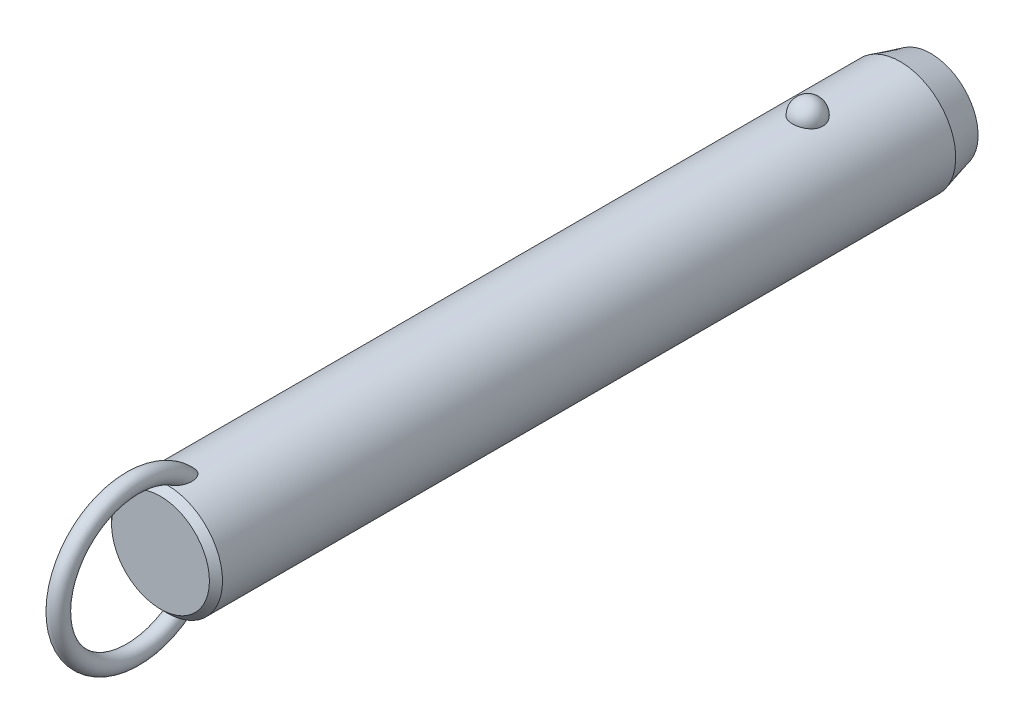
SolidWorks part; units mm, degrees
ref_plane "Front Plane" through (0, 0, 0) normal (0, 0, 1) x (1, 0, 0)
ref_plane "Top Plane" through (0, 0, 0) normal (0, 1, 0) x (1, 0, 0)
ref_plane "Right Plane" through (0, 0, 0) normal (1, 0, 0) x (0, 0, -1)
sketch "Sketch2" plane through (0, 0, 0) normal (0, 0, 1) x (1, 0, 0)
  circle A0 centre (0, 0) radius 12.7
  point P3 (0, 12.7)
  dimension "D1" = 25.4
extrude "Boss-Extrude1" add sketch "Sketch2" along normal blind 132
sketch "Sketch3" plane through (0, 0, 0) normal (0, 0, -1) x (-1, 0, 0)
  circle A0 centre (0, 0) radius 12.7
  dimension "D1" = 25.4
extrude "Boss-Extrude2" add sketch "Sketch3" along normal blind 31.7
chamfer "Chamfer1" distance 7 angle 15 1 edges at (-12.7, 0, -31.7)
sketch "Sketch12" plane through (0, 0, 0) normal (1, 0, 0) x (0, 0, -1)
  line L0 (-132, 12.7) -> (-132, -12.7) construction
  point P0 (-132, 0)
sketch "Sketch13" plane through (0, 0, 0) normal (1, 0, 0) x (0, 0, -1)
  circle A0 centre (-151.05, 0) radius 19.05
  point P2 (-132, 0)
  dimension "D1" = 38.1
sketch "Sketch14" plane through (0, 0, 0) normal (0, 1, 0) x (1, 0, 0)
  circle A0 centre (0, -134) radius 2
  point P2 (0, -132)
  dimension "D1" = 4
sweep "Sweep1" add profiles "Sketch14" path "Sketch13"
sketch "Sketch15" plane through (0, 0, 132) normal (0, 0, 1) x (1, 0, 0)
  circle A0 centre (0, 0) radius 12.7
  dimension "D1" = 25.4
extrude "Boss-Extrude3" add sketch "Sketch15" along normal blind 12.7
chamfer "Chamfer2" distance 1.5 angle 45 1 edges at (12.7, 0, 144.7)
sketch "Sketch18" plane through (0, 0, 0) normal (1, 0, 0) x (0, 0, -1)
  line L0 (24.7, 12.7) -> (-136.851, 12.7) construction
  line L1 (3.5, 16.2) -> (3.5, 9.2)
  line L2 (-136.851, -12.7) -> (24.7, -12.7) construction
  arc A0 (3.5, 16.2) -> (3.5, 9.2) centre (3.5, 12.7) ccw
  point P4 (0, 12.7)
  dimension "D1" = 28.9
revolve "Revolve1" add sketch "Sketch18" angle 360 about L1
